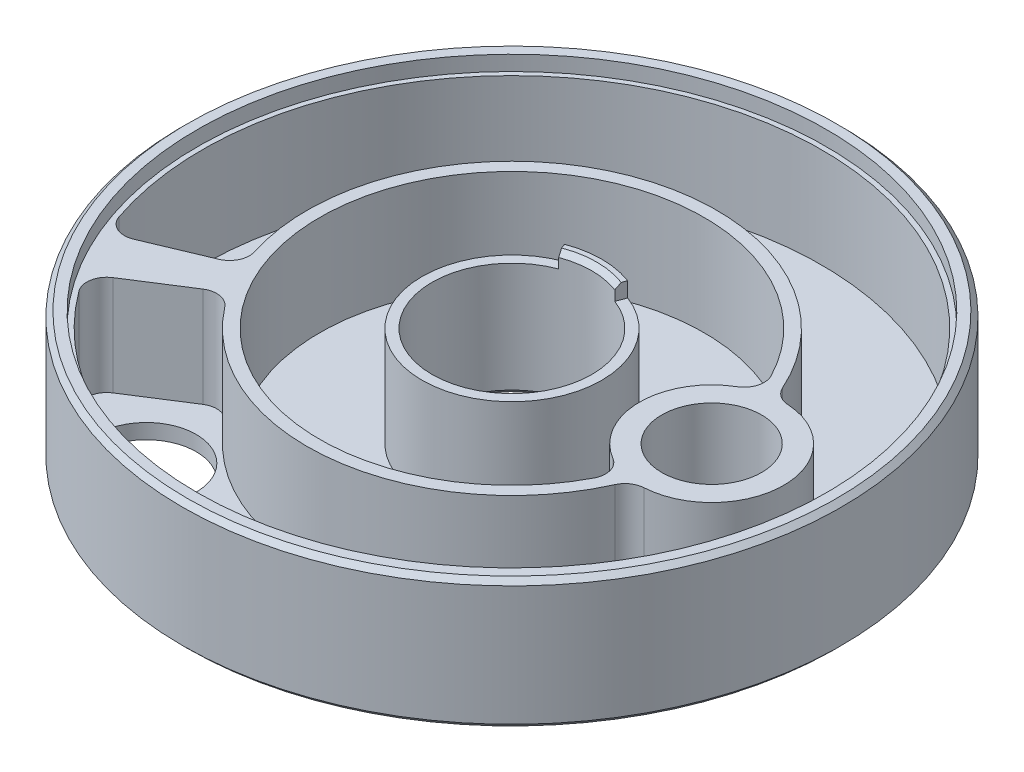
SolidWorks part; units mm, degrees
ref_plane "Front Plane" through (0, 0, 0) normal (0, 0, 1) x (1, 0, 0)
ref_plane "Top Plane" through (0, 0, 0) normal (0, 1, 0) x (1, 0, 0)
ref_plane "Right Plane" through (0, 0, 0) normal (1, 0, 0) x (0, 0, -1)
sketch "Sketch1" plane through (0, 0, 0) normal (0, 1, 0) x (1, 0, 0)
  circle A0 centre (0, 0) radius 8
  circle A1 centre (0, 0) radius 20 construction
  circle A2 centre (0, 0) radius 33
  circle A3 centre (0, 0) radius 14 construction
  circle A4 centre (0, 0) radius 26 construction
extrude "Boss-Extrude1" add sketch "Sketch1" against normal blind 13
sketch "Sketch2" plane through (0, 0, 0) normal (0, 1, 0) x (1, 0, 0)
  line L0 (0, 0) -> (0, 8) construction
  line L1 (0, 8) -> (3, 8) construction
  line L2 (3, 8) -> (2.809, 7.4906) construction
  line L3 (2.809, 7.4906) -> (3, 8)
  line L4 (3, 8) -> (3.1601, 8.427)
  line L5 (-2.809, 7.4906) -> (-3, 8)
  line L6 (-3, 8) -> (-3.1601, 8.427)
  arc A0 (-2.809, 7.4906) -> (2.809, 7.4906) centre (0, 0) ccw
  circle A1 centre (0, 0) radius 31.5
  arc A2 (3.1601, 8.427) -> (-3.1601, 8.427) centre (0, 0) ccw
extrude "Cut-Extrude1" cut sketch "Sketch2" against normal blind 1.5
chamfer "Chamfer1" distance 0.5 angle 45 4 edges at (0, 0, -8) (0, -13, 8) (0, -13, 33) (0, 0, 33)
sketch "Sketch3" plane through (0, -1.5, 0) normal (0, 1, 0) x (1, 0, 0)
  circle A0 centre (20, 0) radius 5
  circle A2 centre (0, 0) radius 20 construction
extrude "Cut-Extrude2" cut sketch "Sketch3" against normal through all
sketch "Sketch4" plane through (0, -1.5, 0) normal (0, 1, 0) x (1, 0, 0)
  line L0 (0, 0) -> (-16.6132, -20) construction
  line L1 (-18.8867, -12.064) -> (-24.3815, -15.5738)
  line L2 (-20.6617, -8.68) -> (-26.6729, -11.2053)
  arc A0 (16.3306, 6.2175) -> (16.3306, -6.2175) centre (20, 0) ccw
  circle A1 centre (0, 0) radius 20 construction
  circle A2 centre (0, 0) radius 9
  arc A3 (-24.9121, -18.4496) -> (-29.3404, -10.007) centre (0, 0) ccw
  circle A4 centre (0, 26) radius 5 construction
  circle A5 centre (0, 0) radius 26 construction
  circle A6 centre (-16.6132, -20) radius 5 construction
  circle A7 centre (0, 0) radius 23.5 construction
  arc A8 (-16.227, -12.5274) -> (18.7063, -8.3861) centre (0, 0) ccw
  circle A9 centre (-7.4626, -22.2836) radius 3 construction
  circle A10 centre (-12.5725, 6.1588) radius 3 construction
  circle A11 centre (0, 0) radius 14 construction
  circle A12 centre (-8.5681, 24.5477) radius 3 construction
  arc A13 (-24.3815, -15.5738) -> (-24.9121, -18.4496) centre (-23.3048, -17.2593) ccw
  arc A14 (18.7063, 8.3861) -> (-19.5309, -6.2285) centre (0, 0) ccw
  arc A15 (17.0896, 8.8605) -> (17.0896, -8.8605) centre (0, 0) ccw
  arc A16 (20.416, -7.2075) -> (20.416, 7.2075) centre (20, 0) ccw
  arc A17 (18.7063, 8.3861) -> (20.416, 7.2075) centre (20.5312, 9.2042) ccw
  arc A18 (18.7063, -8.3861) -> (20.416, -7.2075) centre (20.5312, -9.2042) cw
  arc A19 (17.0896, -8.8605) -> (16.3306, -6.2175) centre (15.3141, -7.9399) ccw
  arc A20 (17.0896, 8.8605) -> (16.3306, 6.2175) centre (15.3141, 7.9399) cw
  arc A22 (-18.8867, -12.064) -> (-16.227, -12.5274) centre (-17.8101, -13.7495) cw
  arc A23 (-26.6729, -11.2053) -> (-29.3404, -10.007) centre (-27.4475, -9.3614) cw
  arc A24 (-20.6617, -8.68) -> (-19.5309, -6.2285) centre (-21.4364, -6.8361) ccw
  point P34 (19.2032, -7.1754)
  point P42 (-17.2763, -11.0354)
  dimension "D1" = 2
  dimension "D2" = 2
extrude "Cut-Extrude3" cut sketch "Sketch4" against normal blind 10
sketch "Sketch5" plane through (0, -11.5, 0) normal (0, 1, 0) x (1, 0, 0)
  circle A0 centre (-16.6132, -20) radius 5
extrude "Cut-Extrude4" cut sketch "Sketch5" against normal through all
